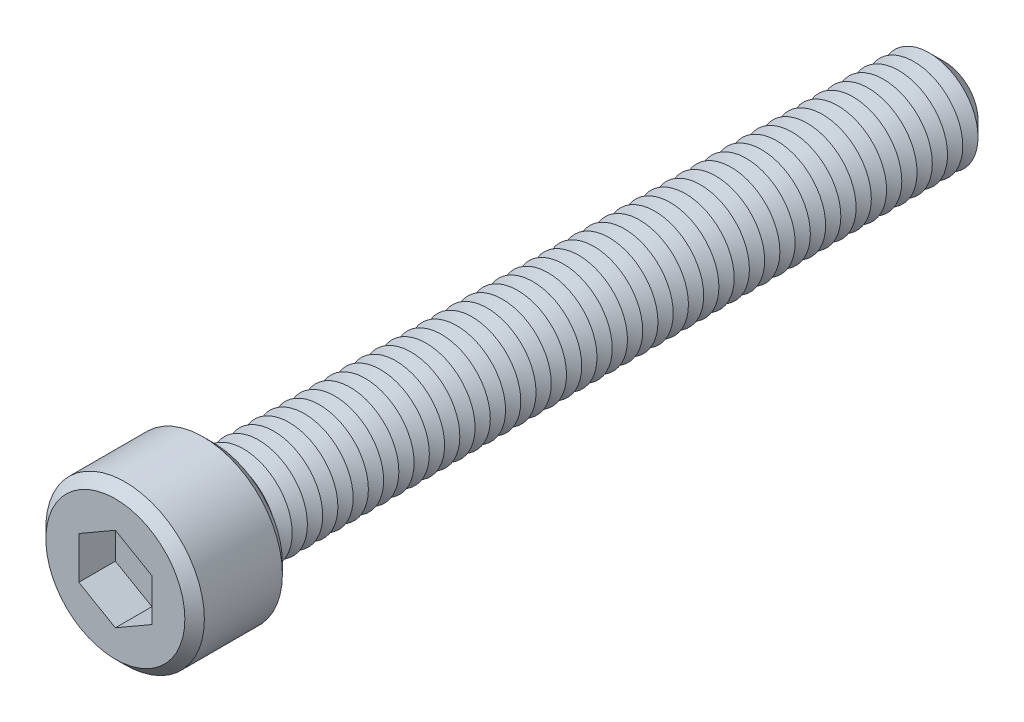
SolidWorks part; units mm, degrees
ref_plane "Front Plane" through (0, 0, 0) normal (0, 0, 1) x (1, 0, 0)
ref_plane "Top Plane" through (0, 0, 0) normal (0, 1, 0) x (1, 0, 0)
ref_plane "Right Plane" through (0, 0, 0) normal (1, 0, 0) x (0, 0, -1)
sketch "Sketch1" plane through (0, 0, 0) normal (0, 0, 1) x (1, 0, 0)
  circle A0 centre (0, 0) radius 6.5
  dimension "D1" = 13
extrude "Boss-Extrude1" add sketch "Sketch1" along normal blind 8
sketch "Sketch2" plane through (0, 0, 0) normal (0, 0, -1) x (-1, 0, 0)
  circle A0 centre (0, 0) radius 4
  dimension "D1" = 8
extrude "Boss-Extrude2" add sketch "Sketch2" along normal blind 60
chamfer "Chamfer1" distance 1.25 angle 45 1 edges at (-4, 0, -60)
sketch "Sketch3" plane through (0, 0, 0) normal (1, 0, 0) x (0, 0, -1)
  line L0 (-2.5121, 0) -> (4.5776, 0) construction
sketch "Sketch4" plane through (0, 0, 0) normal (1, 0, 0) x (0, 0, -1)
  line L0 (0, 4) -> (0.625, 2.9175)
  line L1 (0.625, 2.9175) -> (1.25, 4)
  line L2 (58.75, 4) -> (0, 4) construction
  line L3 (1.25, 4) -> (0, 4)
  dimension "D1" = 1.25
revolve "Cut-Revolve1" cut sketch "Sketch4" angle 360 about L0
pattern_linear "LPattern1" count 47 spacing 1.25 along (0, 0, -1) of "Cut-Revolve1"
sketch "Sketch5" plane through (0, 0, 8) normal (0, 0, 1) x (1, 0, 0)
  line L1 (0, 3.4641) -> (-3, 1.7321)
  line L2 (-3, 1.7321) -> (-3, -1.7321)
  line L3 (-3, -1.7321) -> (0, -3.4641)
  line L4 (0, -3.4641) -> (3, -1.7321)
  line L5 (3, -1.7321) -> (3, 1.7321)
  line L6 (3, 1.7321) -> (0, 3.4641)
  circle A0 centre (0, 0) radius 3 construction
  dimension "D1" = 6
extrude "Cut-Extrude1" cut sketch "Sketch5" against normal blind 3
sketch "Sketch6" plane through (0, 0, 5) normal (0, 0, 1) x (1, 0, 0)
  circle A0 centre (0, 0) radius 0.9
  dimension "D1" = 1.8
extrude "Cut-Extrude2" cut sketch "Sketch6" against normal up to surface (65 mm away)
chamfer "Chamfer2" distance 0.8 angle 45 2 edges at (6.5, 0, 0) (6.5, 0, 8)
